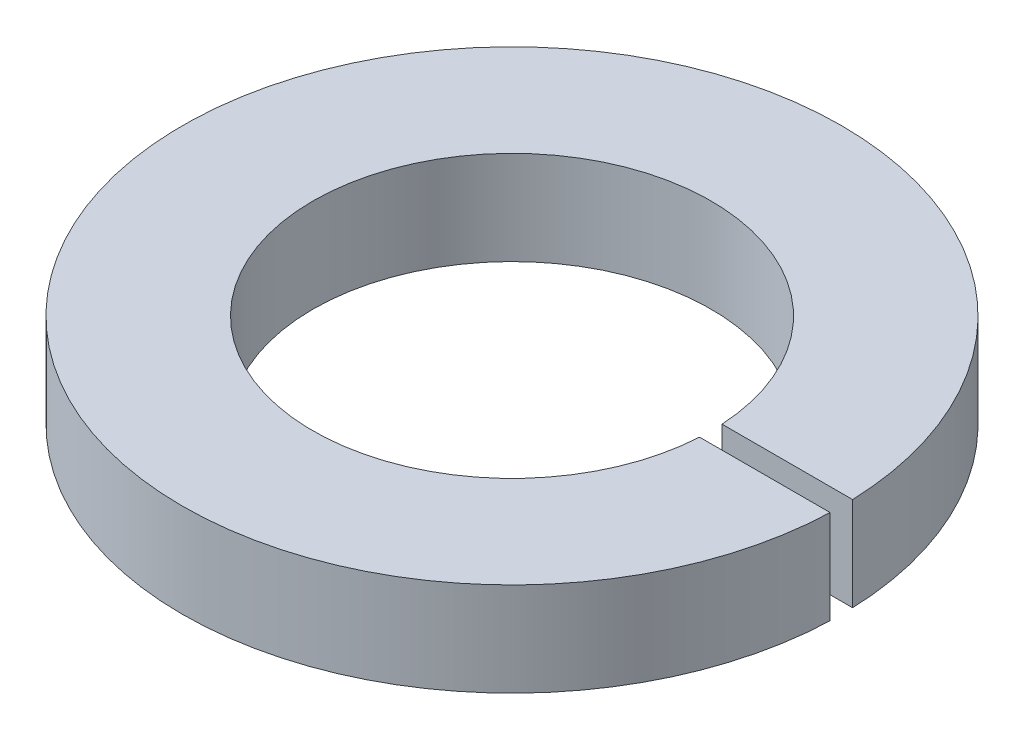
SolidWorks part; units mm, degrees
ref_plane "front" through (0, 0, 0) normal (0, 0, 1) x (1, 0, 0)
ref_plane "top" through (0, 0, 0) normal (0, 1, 0) x (1, 0, 0)
ref_plane "side" through (0, 0, 0) normal (1, 0, 0) x (0, 0, -1)
sketch "Sketch1" plane through (0, 0, 0) normal (0, 1, 0) x (1, 0, 0)
  circle A0 centre (0, 0) radius 6.7437
  circle A1 centre (0, 0) radius 11.1633
  dimension "D1" = 22.3266
  dimension "D2" = 13.4874
extrude "Base-Extrude" add sketch "Sketch1" along normal blind 3.175
sketch "Sketch2" plane through (0, 3.175, 0) normal (0, 1, 0) x (-1, 0, 0)
  line L0 (0, 0) -> (-14.5518, 0) construction
  line L1 (-11.1568, -0.381) -> (0, -0.381)
  line L2 (0, -0.381) -> (0, 0.381)
  line L3 (-11.1568, 0.381) -> (0, 0.381)
  circle A0 centre (0, 0) radius 11.1633 construction
  arc A1 (-11.1568, 0.381) -> (-11.1568, -0.381) centre (0, 0) ccw
  point P7 (-14.0898, 0)
  point P8 (0, 0)
  dimension "D1" = 0.762
extrude "Cut-Extrude1" cut sketch "Sketch2" against normal through all
